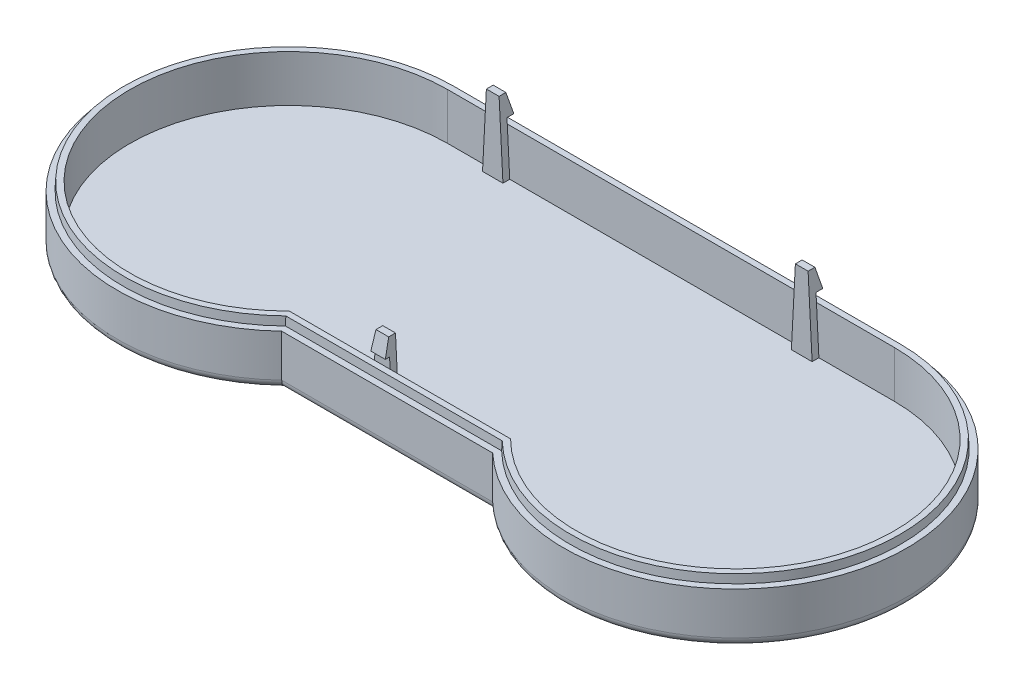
SolidWorks part; units mm, degrees
ref_plane "Front Plane" through (0, 0, 0) normal (0, 0, 1) x (1, 0, 0)
ref_plane "Top Plane" through (0, 0, 0) normal (0, 1, 0) x (1, 0, 0)
ref_plane "Right Plane" through (0, 0, 0) normal (1, 0, 0) x (0, 0, -1)
sketch "Sketch2" plane through (0, 0, 0) normal (0, 1, 0) x (1, 0, 0)
  line L0 (-66.8306, 51.3754) -> (66.8306, 51.3754)
  line L1 (31.5686, -37.3634) -> (-31.5686, -37.3634)
  arc A0 (31.5686, -37.3634) -> (66.8306, 51.3754) centre (66.8306, 0) ccw
  arc A1 (-66.8306, 51.3754) -> (-31.5686, -37.3634) centre (-66.8306, 0) ccw
  point P6 (0, 51.3754)
  point P7 (0, 0)
  dimension "D1" = 133.6612
  dimension "D2" = 88.7389
  dimension "D3" = 51.3754
extrude "Boss-Extrude1" add sketch "Sketch2" along normal blind 15.24
shell "Shell1" thickness 3.81
fillet "Fillet1" radius 2.54 4 edges at (0, 0, -51.3754) (-114.5747, 0, 18.972) (0, 0, 37.3634) (114.5747, 0, 18.972)
other "Lip&Groove1-Lip" parameters "LipHeight"=2.54, "LipWidth"=1.905, "LipDraftAngle"=3, "Clearance"=0, "Gap"=0, "upGap"=2.54, "D7"=1.905, "D8"=3, "D9"=0
sketch3d "3DSketch1"
  line L0 (66.8306, 17.78, -47.5654) -> (-66.8306, 17.78, -47.5654) construction
  point P0 (41.166, 17.78, -47.5654)
other "Snap Hook1" parameters "BaseDepth"=2.032, "TopDepth"=2.032, "Width"=3.81, "HookHeight"=6.35, "Overhang"=2.032, "BodyHeight"=2.54, "Draft"=3, "LipHeight"=0
sketch3d "3DSketch2"
  point P0 (-5.2752, 10.7272, 33.5534)
other "Snap Hook2" parameters "BaseDepth"=2.032, "TopDepth"=2.032, "Width"=3.81, "HookHeight"=5.08, "Overhang"=1.27, "BodyHeight"=10.16, "Draft"=3, "LipHeight"=0
sketch3d "3DSketch3"
  point P0 (-51.3168, 9.2323, -47.5654)
other "Snap Hook3" parameters "BaseDepth"=2.032, "TopDepth"=2.032, "Width"=3.81, "HookHeight"=6.35, "Overhang"=2.032, "BodyHeight"=10.16, "Draft"=3, "LipHeight"=0
